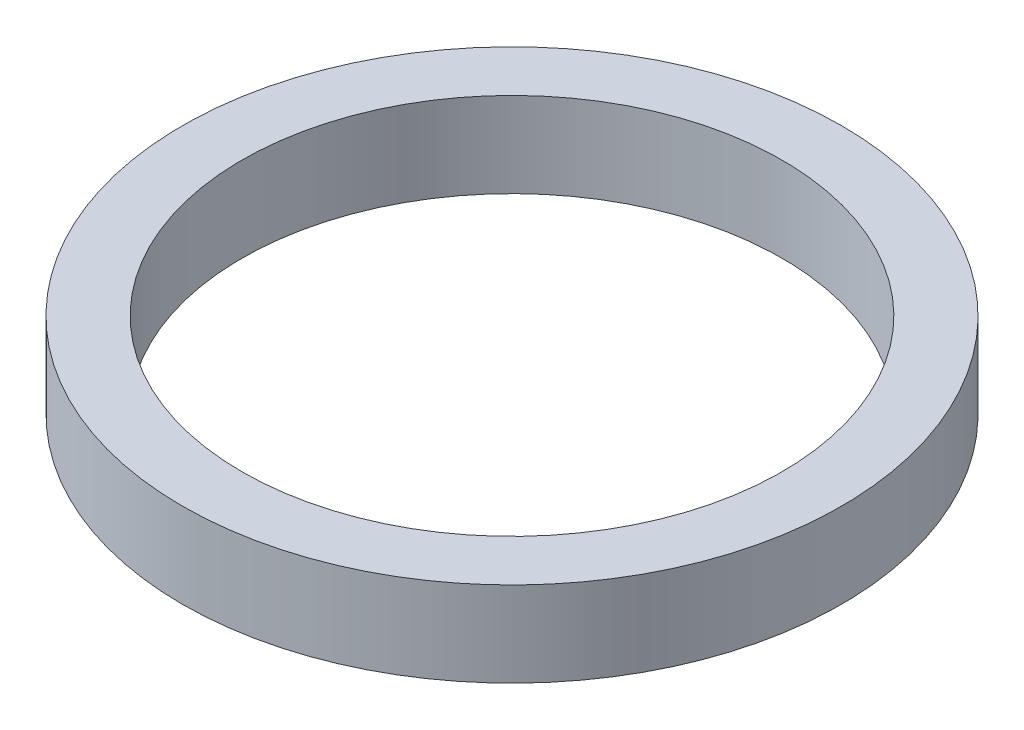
SolidWorks part; units mm, degrees
ref_plane "Front Plane" through (0, 0, 0) normal (0, 0, 1) x (1, 0, 0)
ref_plane "Top Plane" through (0, 0, 0) normal (0, 1, 0) x (1, 0, 0)
ref_plane "Right Plane" through (0, 0, 0) normal (1, 0, 0) x (0, 0, -1)
sketch "Sketch1" plane through (0, 0, 0) normal (0, 1, 0) x (1, 0, 0)
  circle A0 centre (0, 0) radius 15.875
  circle A1 centre (0, 0) radius 19.375
  dimension "D1" = 31.75
  dimension "D2" = 38.75
extrude "Boss-Extrude1" add sketch "Sketch1" along normal blind 5
